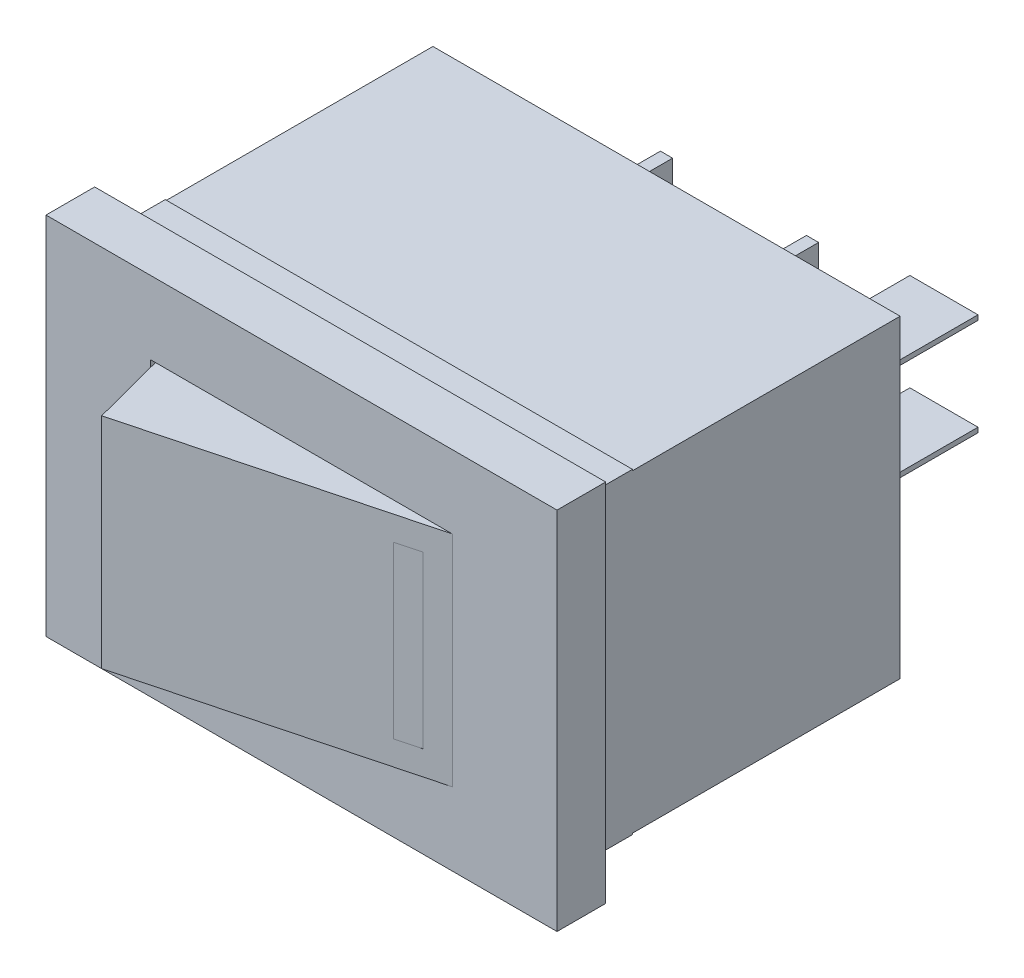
SolidWorks part; units mm, degrees
ref_plane "Front Plane" through (0, 0, 0) normal (0, 0, 1) x (1, 0, 0)
ref_plane "Top Plane" through (0, 0, 0) normal (0, 1, 0) x (1, 0, 0)
ref_plane "Right Plane" through (0, 0, 0) normal (1, 0, 0) x (0, 0, -1)
sketch "Sketch1" plane through (0, 0, 0) normal (0, 0, 1) x (1, 0, 0)
  line L1 (-10.5, 7.5) -> (10.5, 7.5)
  line L2 (-10.5, 7.5) -> (-10.5, -7.5)
  line L3 (-10.5, -7.5) -> (10.5, -7.5)
  line L4 (10.5, 7.5) -> (10.5, -7.5)
extrude "Boss-Extrude1" add sketch "Sketch1" along normal blind 2
sketch "Sketch2" plane through (0, 0, 0) normal (0, 0, -1) x (-1, 0, 0)
  line L1 (-9.6, 6.45) -> (9.6, 6.45)
  line L2 (-9.6, 6.45) -> (-9.6, -6.45)
  line L3 (-9.6, -6.45) -> (9.6, -6.45)
  line L4 (9.6, 6.45) -> (9.6, -6.45)
extrude "Boss-Extrude2" add sketch "Sketch2" along normal blind 13
sketch "Sketch3" plane through (0, 0, -13) normal (0, 0, -1) x (-1, 0, 0)
  line L1 (-0.25, 1.4) -> (0.25, 1.4)
  line L2 (-0.25, 1.4) -> (-0.25, -1.4)
  line L3 (-0.25, -1.4) -> (0.25, -1.4)
  line L4 (0.25, 1.4) -> (0.25, -1.4)
  line L5 (5.75, 1.4) -> (6.25, 1.4)
  line L6 (5.75, 1.4) -> (5.75, -1.4)
  line L7 (5.75, -1.4) -> (6.25, -1.4)
  line L8 (6.25, 1.4) -> (6.25, -1.4)
  line L9 (-6.8, 2.1) -> (-4, 2.1)
  line L10 (-6.8, 2.1) -> (-6.8, 1.9)
  line L11 (-6.8, 1.9) -> (-4, 1.9)
  line L12 (-4, 2.1) -> (-4, 1.9)
  line L13 (-6.8, -1.9) -> (-4, -1.9)
  line L14 (-6.8, -1.9) -> (-6.8, -2.1)
  line L15 (-6.8, -2.1) -> (-4, -2.1)
  line L16 (-4, -1.9) -> (-4, -2.1)
extrude "Boss-Extrude3" add sketch "Sketch3" along normal blind 6 separate body
sketch "Sketch4" plane through (0, 0, 2) normal (0, 0, 1) x (1, 0, 0)
  line L1 (-6.2, 4.5) -> (6.2, 4.5)
  line L2 (-6.2, 4.5) -> (-6.2, -4.5)
  line L3 (-6.2, -4.5) -> (6.2, -4.5)
  line L4 (6.2, 4.5) -> (6.2, -4.5)
extrude "Cut-Extrude1" cut sketch "Sketch4" against normal blind 6
sketch3d "3DSketch1"
  line L4 (6.2, 0, 2) -> (-5.2126, 0, 4.9986)
  line L5 (6.2, -4.5, 2) -> (6.2, 4.5, 2) construction
  line L6 (-5.2126, 0, 4.9986) -> (-6.3737, 0, 0.5798)
  line L7 (-6.3737, 0, 0.5798) -> (5.039, 0, -2.4188)
  line L8 (5.039, 0, -2.4188) -> (6.2, 0, 2)
extrude "Boss-Extrude8" add sketch "3DSketch1" along direction (0, -1, 0) on the side against the normal blind 4.5 and the other way blind 4.5 separate body
sketch "Sketch6" plane through (0.8919, 0, 3.3947) normal (0.2541, 0, 0.9672) x (0.9672, 0, -0.2541)
  line L1 (3.5, 3.5) -> (4.5, 3.5)
  line L2 (3.5, 3.5) -> (3.5, -3.5)
  line L3 (3.5, -3.5) -> (4.5, -3.5)
  line L4 (4.5, 3.5) -> (4.5, -3.5)
extrude "Cut-Extrude2" cut sketch "Sketch6" against normal blind 0.001
sketch "Sketch7" plane through (0, 0, 0) normal (0, 0, -1) x (-1, 0, 0)
  line L2 (9.6, -6.45) -> (-9.6, -6.45)
  line L3 (9.6, -6.45) -> (9.6, -6.5)
  line L4 (9.6, -6.5) -> (-9.6, -6.5)
  line L5 (-9.6, -6.45) -> (-9.6, -6.5)
  line L6 (-9.6, 6.45) -> (9.6, 6.45)
  line L7 (-9.6, 6.45) -> (-9.6, 6.5)
  line L8 (-9.6, 6.5) -> (9.6, 6.5)
  line L9 (9.6, 6.45) -> (9.6, 6.5)
extrude "Boss-Extrude9" add sketch "Sketch7" along normal blind 2
